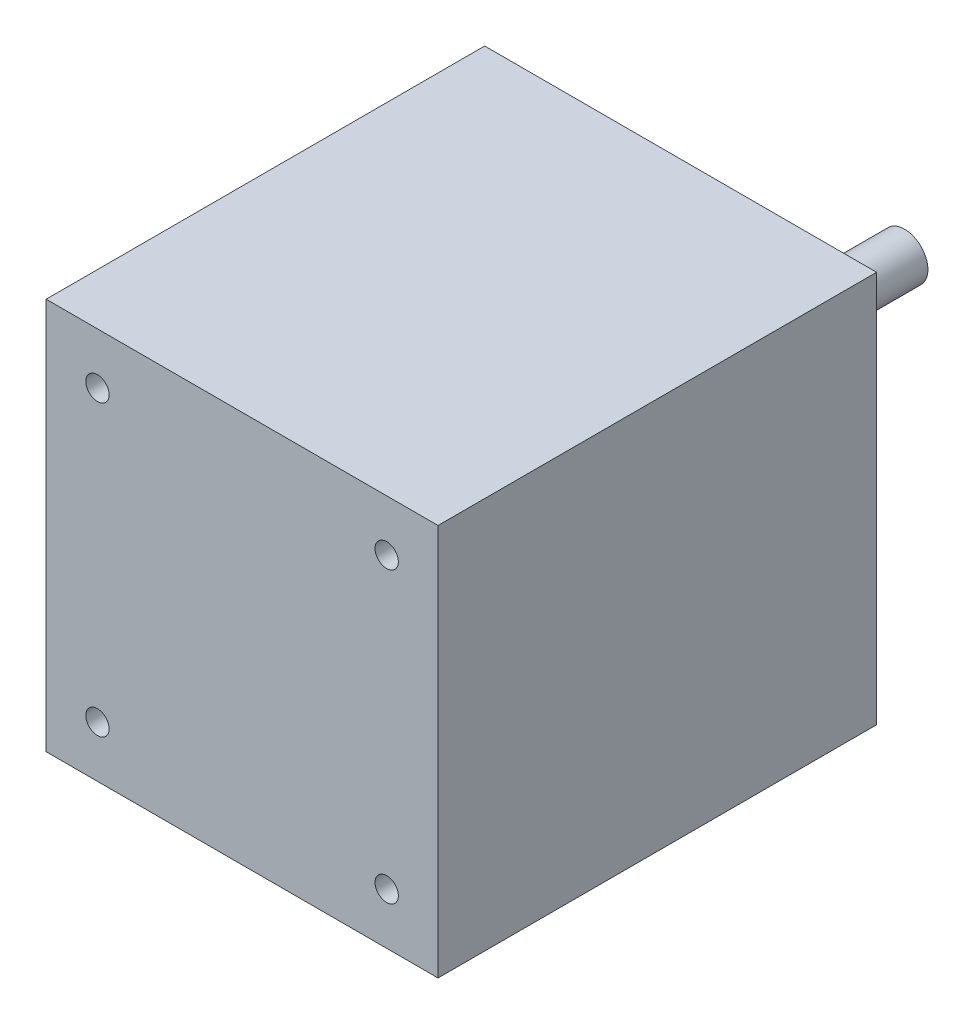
SolidWorks part; units mm, degrees
ref_plane "Front Plane" through (0, 0, 0) normal (0, 0, 1) x (1, 0, 0)
ref_plane "Top Plane" through (0, 0, 0) normal (0, 1, 0) x (1, 0, 0)
ref_plane "Right Plane" through (0, 0, 0) normal (1, 0, 0) x (0, 0, -1)
sketch "Sketch1" plane through (0, 0, 0) normal (0, 0, 1) x (1, 0, 0)
  line L0 (0, -1000) -> (0, 49000) construction
  line L1 (-21, 21) -> (21, 21)
  line L2 (-21, 21) -> (-21, -21)
  line L3 (-21, -21) -> (21, -21)
  line L4 (21, 21) -> (21, -21)
  line L5 (-21, 21) -> (21, -21) construction
  line L6 (-21, -21) -> (21, 21) construction
  line L7 (-1000, 0) -> (49000, 0) construction
  circle A0 centre (-15.5, 15.5) radius 1.25
  circle A1 centre (15.5, 15.5) radius 1.25
  circle A2 centre (15.5, -15.5) radius 1.25
  circle A3 centre (-15.5, -15.5) radius 1.25
  point P0 (0, 0)
  dimension "D2" = 2.5
  dimension "D1" = 42
  dimension "D3" = 31
extrude "Boss-Extrude1" add sketch "Sketch1" along normal blind 47
sketch "Sketch2" plane through (0, 0, 0) normal (0, 0, -1) x (-1, 0, 0)
  circle A0 centre (0, 0) radius 11
  dimension "D1" = 22
extrude "Boss-Extrude2" add sketch "Sketch2" along normal blind 2
sketch "Sketch3" plane through (0, 0, -2) normal (0, 0, -1) x (-1, 0, 0)
  circle A0 centre (0, 0) radius 2.5
  dimension "D1" = 5
extrude "Boss-Extrude3" add sketch "Sketch3" along normal blind 22
